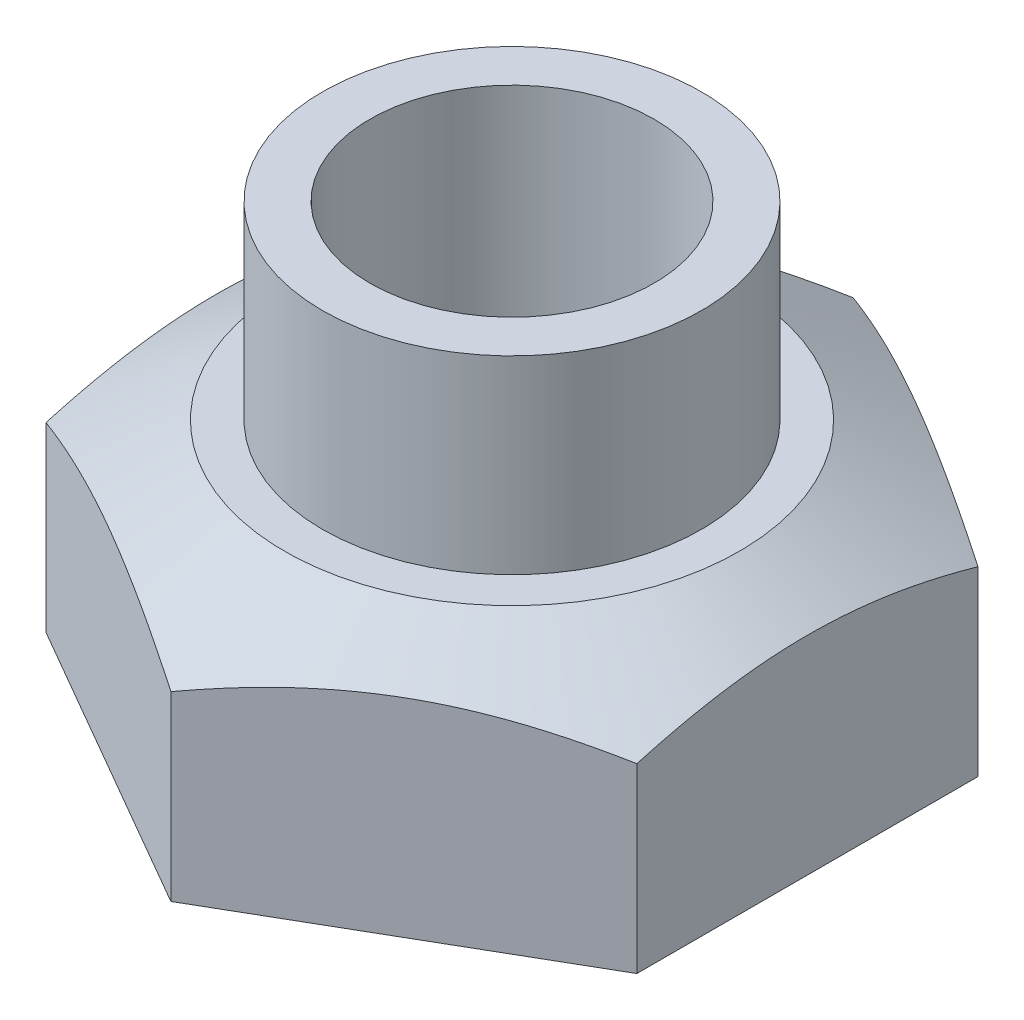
SolidWorks part; units mm, degrees
ref_plane "Front Plane" through (0, 0, 0) normal (0, 0, 1) x (1, 0, 0)
ref_plane "Top Plane" through (0, 0, 0) normal (0, 1, 0) x (1, 0, 0)
ref_plane "Right Plane" through (0, 0, 0) normal (1, 0, 0) x (0, 0, -1)
sketch "Sketch1" plane through (0, 0, 0) normal (0, 1, 0) x (1, 0, 0)
  line L1 (0, -90) -> (77.9423, -45)
  line L2 (77.9423, -45) -> (77.9423, 45)
  line L3 (77.9423, 45) -> (0, 90)
  line L4 (0, 90) -> (-77.9423, 45)
  line L5 (-77.9423, 45) -> (-77.9423, -45)
  line L6 (-77.9423, -45) -> (0, -90)
  circle A0 centre (0, 0) radius 77.9423 construction
  dimension "D1" = 180
extrude "Boss-Extrude1" add sketch "Sketch1" along normal blind 65
sketch "Sketch2" plane through (0, 0, 0) normal (1, 0, 0) x (0, 0, -1)
  line L0 (60, 65) -> (112.7967, 95)
  line L1 (45, 65) -> (90, 65) construction
  line L2 (112.7967, 95) -> (112.7967, 35)
  line L3 (112.7967, 35) -> (60, 65)
  line L5 (0, 0) -> (0, 73.6942) construction
  circle A0 centre (90, 65) radius 30 construction
  point P10 (62.3415, 65)
  point P11 (90, 35)
  point P12 (107.2704, 35)
  dimension "D2" = 60
  dimension "D1" = 30
revolve "Cut-Revolve2" cut sketch "Sketch2" angle 360 about L5
sketch "Sketch3" plane through (0, 65, 0) normal (0, 1, 0) x (1, 0, 0)
  circle A0 centre (0, 0) radius 37.5
  dimension "D1" = 75
extrude "Cut-Extrude1" cut sketch "Sketch3" against normal up to surface (65 mm away)
sketch "Sketch4" plane through (0, 65, 0) normal (0, 1, 0) x (1, 0, 0)
  circle A0 centre (0, 0) radius 50
  circle A1 centre (0, 0) radius 37.5
  dimension "D1" = 100
  dimension "D2" = 75
extrude "Boss-Extrude2" add sketch "Sketch4" along normal blind 50
